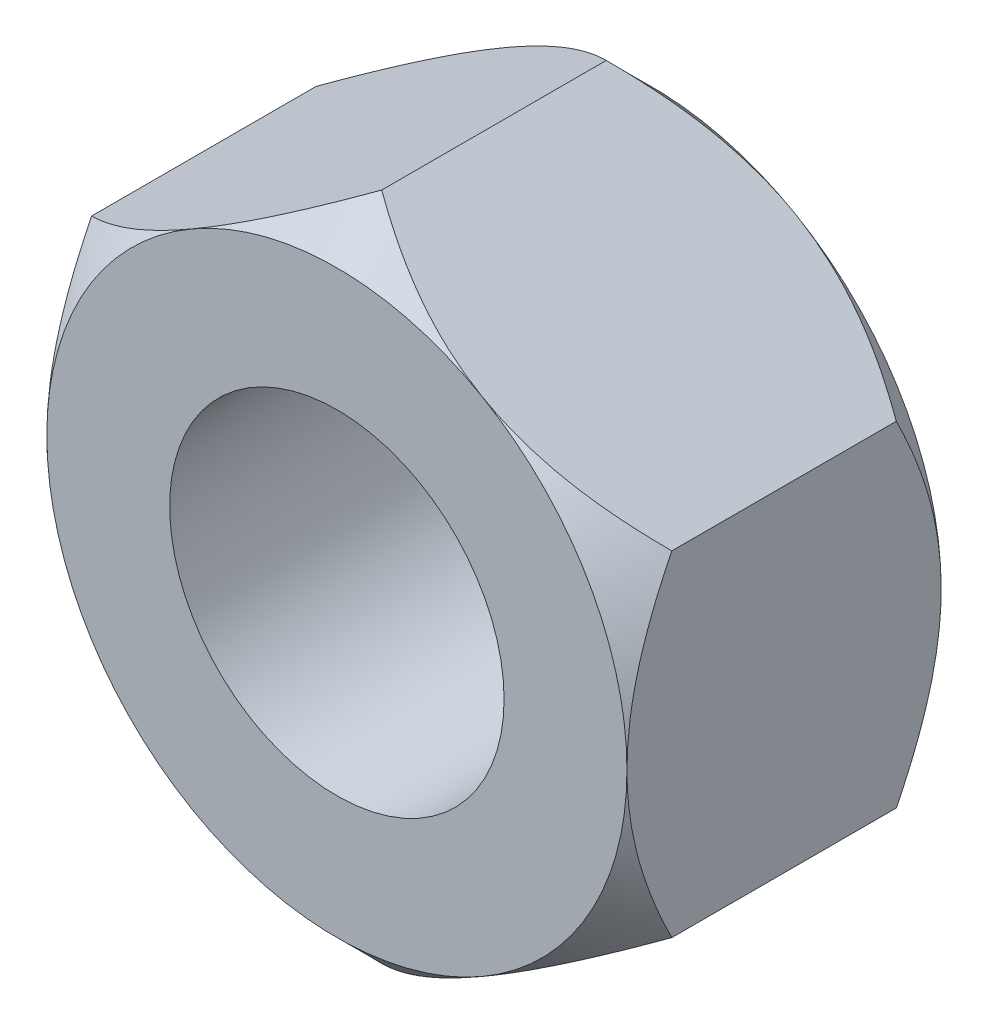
SolidWorks part; units mm, degrees
ref_plane "Front" through (0, 0, 0) normal (0, 0, 1) x (1, 0, 0)
ref_plane "Top" through (0, 0, 0) normal (0, 1, 0) x (1, 0, 0)
ref_plane "Right" through (0, 0, 0) normal (1, 0, 0) x (0, 0, -1)
sketch "Sketch1" plane through (0, 0, 0) normal (0, 0, 1) x (1, 0, 0)
  line L0 (0, 0) -> (0, 13.8564) construction
  line L1 (0, 0) -> (-12, 0) construction
  line L2 (12, 6.9282) -> (12, -6.9282)
  line L3 (12, 6.9282) -> (0, 13.8564)
  line L4 (-12, 6.9282) -> (0, 13.8564)
  line L5 (-12, 6.9282) -> (-12, -6.9282)
  line L6 (-12, -6.9282) -> (0, -13.8564)
  line L7 (12, -6.9282) -> (0, -13.8564)
  point P12 (12, 0)
  dimension "D1" = 60
extrude "Base-Extrude" add sketch "Sketch1" along normal mid plane 13
sketch "Sketch3" plane through (0, 0, 0) normal (0, 1, 0) x (1, 0, 0)
  line L1 (-12, 6.5) -> (0, 6.5) construction
  line L2 (-12, -6.5) -> (-12, 6.5) construction
  line L3 (-17, 6.5) -> (-12, 6.5)
  line L4 (-12, 6.5) -> (-17, 1.5)
  line L5 (-17, 1.5) -> (-17, 6.5)
  line L6 (0, 6.5) -> (0, -3.8824) construction
  dimension "D1" = 5
  dimension "D2" = 45
revolve "Cut-Revolve1" cut sketch "Sketch3" angle 360 about L6
mirror "Mirror1" about plane through (0, 0, 0) normal (0, 0, 1) of "Cut-Revolve1"
sketch "Sketch4" plane through (0, 0, 6.5) normal (0, 0, 1) x (1, 0, 0)
  circle A0 centre (0, 0) radius 6.9175
  dimension "d" = 13.835
extrude "Cut-Extrude1" cut sketch "Sketch4" against normal through all
